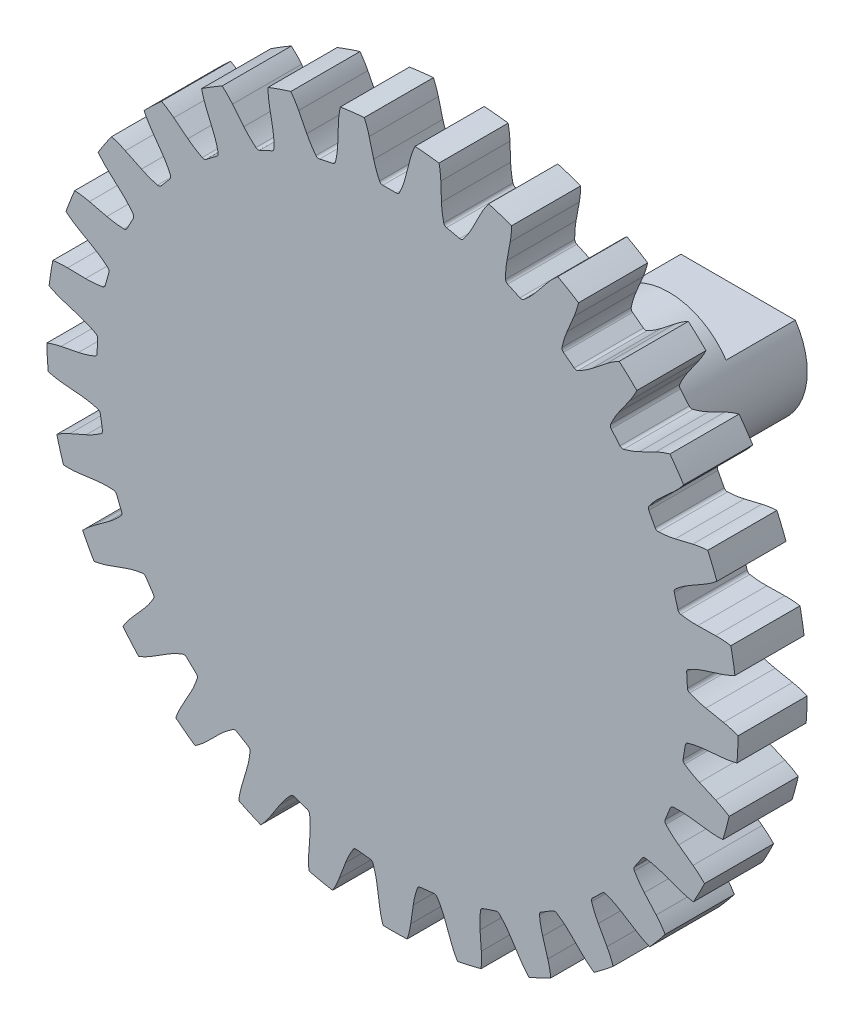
SolidWorks part; units mm, degrees
ref_plane "Front" through (0, 0, 0) normal (0, 0, 1) x (1, 0, 0)
ref_plane "Top" through (0, 0, 0) normal (0, 1, 0) x (1, 0, 0)
ref_plane "Right" through (0, 0, 0) normal (1, 0, 0) x (0, 0, -1)
sketch "Sketch1" plane through (0, 0, 0) normal (0, 0, 1) x (1, 0, 0)
  line L0 (0, 0) -> (0, 63.5) construction
  circle A1 centre (0, 0) radius 63.5
  dimension "D1" = 127
extrude "Extrude1" add sketch "Sketch1" along normal blind 12.7
sketch "Sketch2" [suppressed] plane through (0, 0, 12.7) normal (0, 0, 1) x (1, 0, 0)
  line L0 (0, 0) -> (0, 31.75) construction
  line L1 (3.7322, 29.8519) -> (3.81, 30.3599)
  line L2 (-3.7322, 29.8519) -> (-3.81, 30.3599)
  circle A0 centre (0, 0) radius 63.5 construction
  arc A1 (1.905, 24.0099) -> (-1.905, 24.0099) centre (0, 0) ccw
  arc A2 (1.905, 24.0099) -> (3.7322, 29.8519) centre (-16.3537, 32.9275) ccw
  arc A3 (3.81, 30.3599) -> (4.0769, 31.4872) centre (10.922, 29.2709) cw
  arc A4 (-3.81, 30.3599) -> (-4.0769, 31.4872) centre (-10.922, 29.2709) ccw
  arc A5 (-1.905, 24.0099) -> (-3.7322, 29.8519) centre (16.3537, 32.9275) cw
  dimension "D1" = 7.62
  dimension "D2" = 20.32
  dimension "D4" = 6.35
  dimension "D5" = 3.81
  dimension "D3" = 0.508
extrude "Cut-Extrude1" [suppressed] cut sketch "Sketch2" against normal through all and the other way through all flip side to cut
fillet "Fillet1" [suppressed] radius 0.635
pattern_circular "CirPattern1" [suppressed] count 31 over 360
pattern_circular "CirPattern2" [suppressed] count 16 over 360
sketch "Sketch3" plane through (0, 0, 0) normal (0, 0, -1) x (-1, 0, 0)
  circle A0 centre (0, 0) radius 12.7
  dimension "D1" = 25.4
extrude "Extrude2" add sketch "Sketch3" along normal blind 50.8
sketch "Sketch4" plane through (-0.5363, -17.3542, 12.7) normal (0, 0, 1) x (1, 0, 0)
  line L2 (-1.2213, 71.5867) -> (1.2586, 71.5867)
  line L5 (2.9317, 74.8923) -> (3.7553, 78.077)
  line L7 (-2.8944, 74.8923) -> (-3.718, 78.077)
  line L11 (6.5556, 74.8351) -> (0.4659, 74.8351) construction
  line L14 (0.6035, 77.7923) -> (7.0068, 77.7923) construction
  circle A0 centre (0.5363, 17.3542) radius 63.5 construction
  arc A3 (4.6939, 80.718) -> (3.7553, 78.077) centre (19.1247, 74.1022) ccw
  arc A4 (1.8571, 71.9622) -> (2.9317, 74.8923) centre (-12.4376, 78.8671) ccw
  arc A7 (1.2586, 71.5867) -> (1.8571, 71.9622) centre (1.2586, 72.2513) ccw
  arc A8 (-1.2213, 71.5867) -> (-1.8197, 71.9622) centre (-1.2213, 72.2513) cw
  arc A9 (-1.8197, 71.9622) -> (-2.8944, 74.8923) centre (12.475, 78.8671) cw
  arc A10 (-4.6566, 80.718) -> (-3.718, 78.077) centre (-19.0873, 74.1022) cw
  point P2 (0.0187, 80.718)
  point P7 (3.3435, 76.4847)
  point P9 (-3.3249, 76.2)
  point P13 (0, 76.2)
  point P50 (0.0187, 71.5867)
  dimension "D5" = 0.6646
  dimension "D2" = 15.875
extrude "Cut-Extrude2" cut sketch "Sketch4" against normal through all flip side to cut
pattern_circular "CirPattern3" count 29 over 360 about axis through (0, 0, 0) along (0, 0, 1) of "Cut-Extrude2"
sketch "Sketch5" plane through (0, 0, -50.8) normal (0, 0, -1) x (-1, 0, 0)
  line L0 (-10.5019, 7.1414) -> (10.5019, 7.1414)
  circle A0 centre (0, 0) radius 12.7 construction
  circle A1 centre (0, 0) radius 12.7 construction
  arc A2 (-10.5019, 7.1414) -> (10.5019, 7.1414) centre (0, 0) cw
extrude "Cut-Extrude3" cut sketch "Sketch5" against normal blind 12.7
